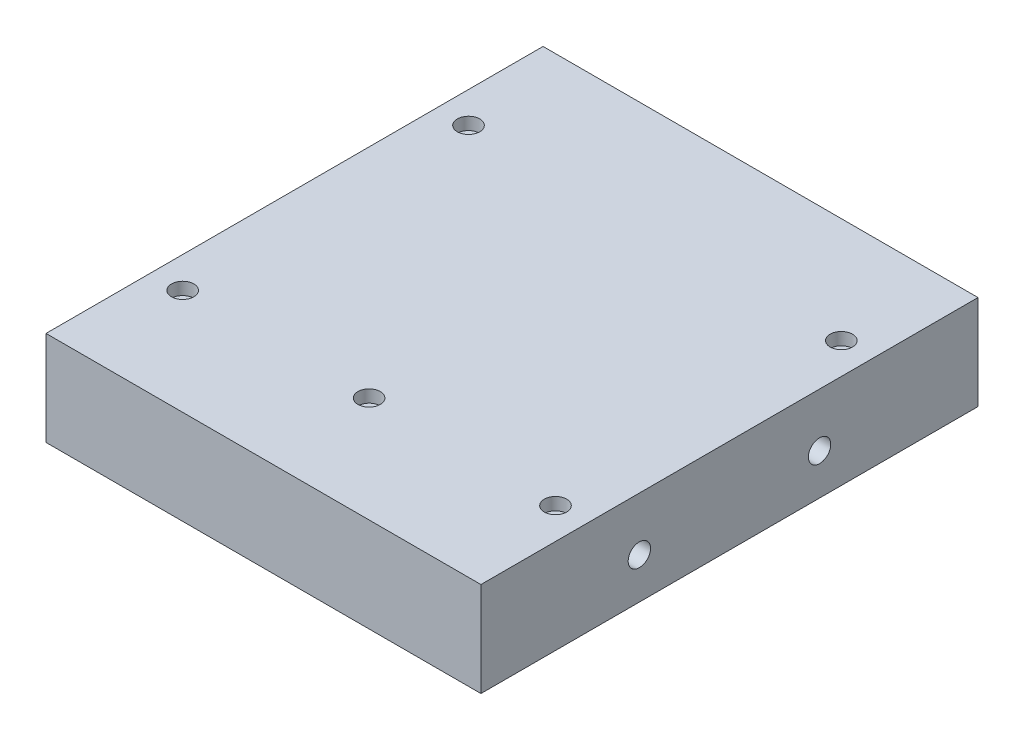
SolidWorks part; units mm, degrees
ref_plane "Front Plane" through (0, 0, 0) normal (0, 0, 1) x (1, 0, 0)
ref_plane "Top Plane" through (0, 0, 0) normal (0, 1, 0) x (1, 0, 0)
ref_plane "Right Plane" through (0, 0, 0) normal (1, 0, 0) x (0, 0, -1)
sketch "Sketch1" plane through (0, 0, 0) normal (0, 1, 0) x (1, 0, 0)
  line L1 (-22.225, -25.4) -> (22.225, -25.4)
  line L2 (-22.225, -25.4) -> (-22.225, 25.4)
  line L3 (-22.225, 25.4) -> (22.225, 25.4)
  line L4 (22.225, -25.4) -> (22.225, 25.4)
  line L5 (-22.225, -25.4) -> (22.225, 25.4) construction
  line L6 (-22.225, 25.4) -> (22.225, -25.4) construction
  point P0 (0, 0)
extrude "Boss-Extrude1" add sketch "Sketch1" along normal blind 9.652
sketch "Sketch2" plane through (0, 9.652, 0) normal (0, 1, 0) x (1, 0, 0)
  circle A25 centre (0, -14.605) radius 1.143
  circle A26 centre (-19.05, -14.605) radius 1.143
  circle A27 centre (19.05, -14.605) radius 1.143
  circle A28 centre (-19.05, 14.605) radius 1.143
  circle A29 centre (19.05, 14.605) radius 1.143
extrude "Cut-Extrude1" cut sketch "Sketch2" against normal blind 1.27
sketch "Sketch3" plane through (-22.225, 0, 0) normal (-1, 0, 0) x (0, 0, 1)
  circle A0 centre (-9.2075, 4.191) radius 1.143
  circle A1 centre (9.2075, 4.191) radius 1.143
extrude "Cut-Extrude2" cut sketch "Sketch3" against normal blind 10.16
sketch "Sketch4" plane through (22.225, 0, 0) normal (1, 0, 0) x (0, 0, -1)
  circle A0 centre (-9.2075, 4.191) radius 1.143
  circle A1 centre (9.2075, 4.191) radius 1.143
extrude "Cut-Extrude3" cut sketch "Sketch4" against normal blind 10.16
